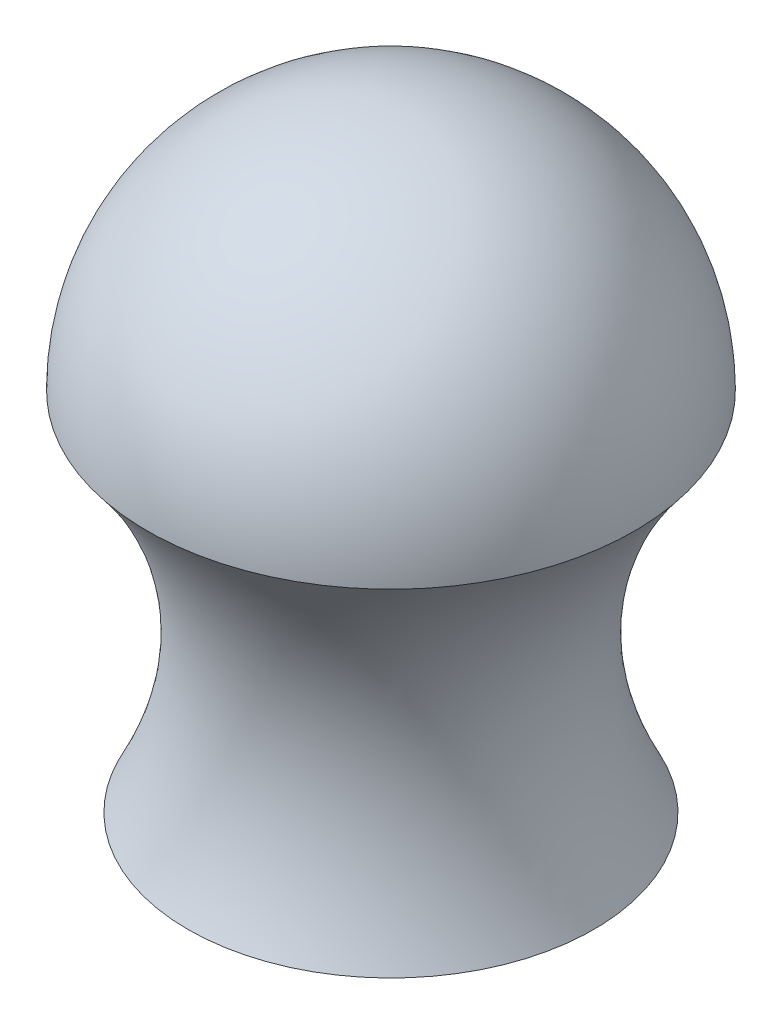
SolidWorks part; units mm, degrees
ref_plane "Front Plane" through (0, 0, 0) normal (0, 0, 1) x (1, 0, 0)
ref_plane "Top Plane" through (0, 0, 0) normal (0, 1, 0) x (1, 0, 0)
ref_plane "Right Plane" through (0, 0, 0) normal (1, 0, 0) x (0, 0, -1)
sketch "Sketch2" plane through (0, 0, 0) normal (1, 0, 0) x (0, 0, -1)
  line L0 (12.7, -22.86) -> (0, -22.86)
  line L1 (0, -22.86) -> (0, 15.24)
  arc A0 (0, 15.24) -> (15.24, 0) centre (0, 0) cw
  spline S0 degree 2 poles (15.24, 0) (6.5824, -10.7777) (12.7, -22.86) knots 0 0 0 1 1 1
  dimension "D3" = 15.24
  dimension "D1" = 12.7
  dimension "D2" = 38.1
revolve "Revolve1" add sketch "Sketch2" angle 360 about L1
sketch "Sketch3" plane through (0, -22.86, 0) normal (0, -1, 0) x (1, 0, 0)
  circle A0 centre (0, 0) radius 2.54
  dimension "D1" = 5.08
extrude "Cut-Extrude1" cut sketch "Sketch3" against normal blind 10.16
